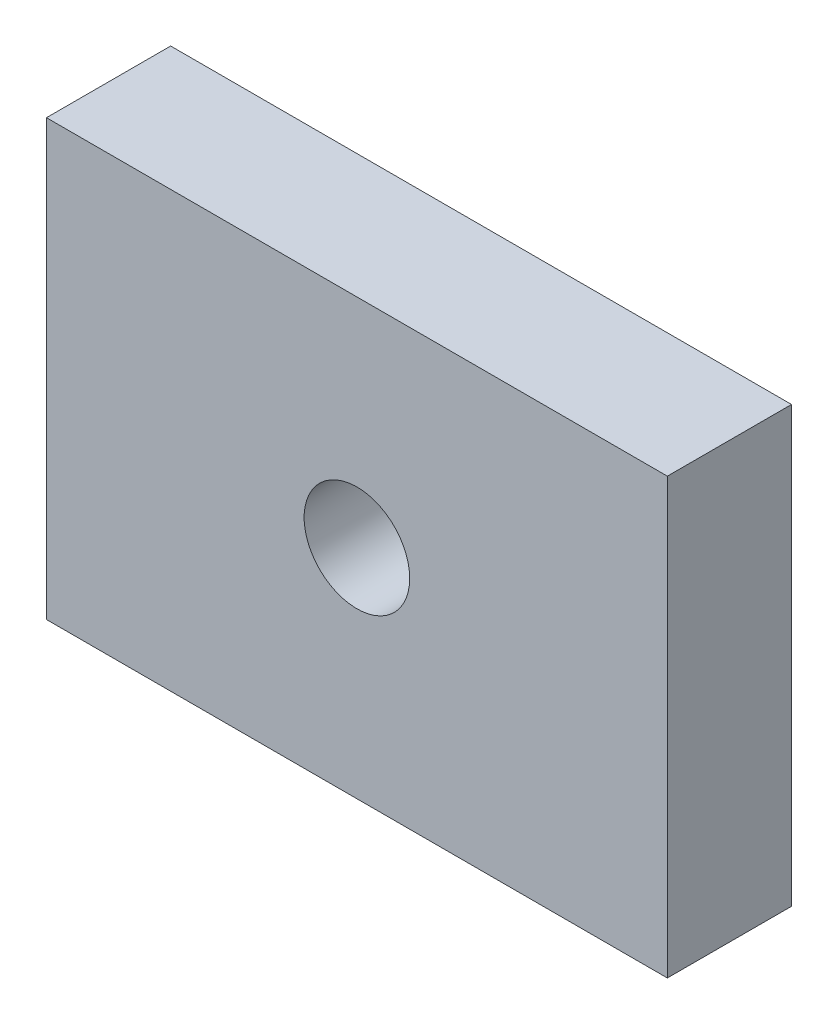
SolidWorks part; units mm, degrees
ref_plane "Ebene vorne" through (0, 0, 0) normal (0, 0, 1) x (1, 0, 0)
ref_plane "Ebene oben" through (0, 0, 0) normal (0, 1, 0) x (1, 0, 0)
ref_plane "Ebene rechts" through (0, 0, 0) normal (1, 0, 0) x (0, 0, -1)
sketch "Skizze1" plane through (0, 0, 0) normal (0, 0, 1) x (1, 0, 0)
  line L1 (0, 0) -> (50, 0)
  line L2 (0, 0) -> (0, 35)
  line L3 (0, 35) -> (50, 35)
  line L4 (50, 0) -> (50, 35)
  dimension "D1" = 35
  dimension "D2" = 50
extrude "Linear austragen1" add sketch "Skizze1" along normal blind 10
hole_wizard "M10 Gewindebohrung1" positions "Skizze3" profile "Skizze2" tap size "M10" standard "DIN"
sketch "Skizze3" plane through (0, 0, 10) normal (0, 0, 1) x (1, 0, 0)
  line L0 (50, 35) -> (0, 35) construction
  line L1 (50, 0) -> (50, 35) construction
  point P0 (25, 17.5)
  dimension "D1" = 17.5
  dimension "D2" = 25
sketch "Skizze2" plane through (25, 17.5, 10) normal (1, 0, 0) x (0, -1, 0)
  line L0 (0, 0) -> (0, 30.0537)
  line L1 (0, 30.0537) -> (4.25, 27.5)
  line L2 (4.25, 27.5) -> (4.25, 0)
  line L5 (4.25, 0) -> (0, 0)
  line L10 (0, 30.0537) -> (-4.25, 27.5) construction
  line L11 (0, -6.35) -> (0, 107.95) construction
  dimension "Bohrerdurchmesser" = 8.5
  dimension "Bohrungstiefe" = 27.5
  dimension "Spitzenwinkel" = 118
